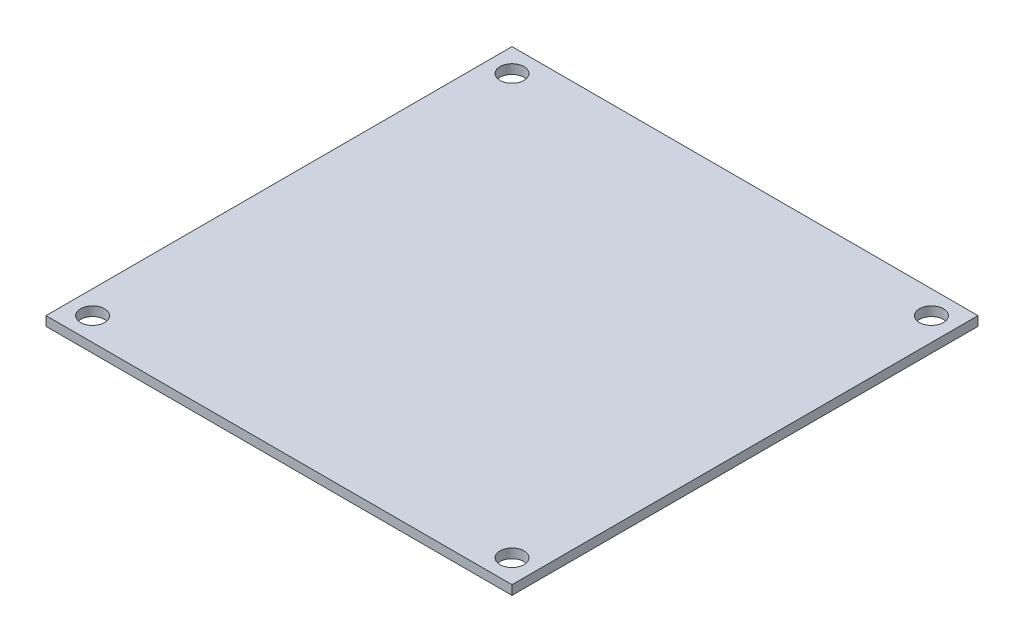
SolidWorks part; units mm, degrees
ref_plane "Front Plane" through (0, 0, 0) normal (0, 0, 1) x (1, 0, 0)
ref_plane "Top Plane" through (0, 0, 0) normal (0, 1, 0) x (1, 0, 0)
ref_plane "Right Plane" through (0, 0, 0) normal (1, 0, 0) x (0, 0, -1)
sketch "Sketch1" plane through (0, 0, 0) normal (0, 1, 0) x (1, 0, 0)
  line L1 (0, 0) -> (63.5, 0)
  line L2 (0, 0) -> (0, 63.5)
  line L3 (0, 63.5) -> (63.5, 63.5)
  line L4 (63.5, 0) -> (63.5, 63.5)
  dimension "D1" = 63.5
  dimension "D2" = 63.5
extrude "Extrude1" add sketch "Sketch1" against normal blind 1.27
hole_wizard "#4 Clearance Hole1" positions "3DSketch1" profile "Sketch2" hole size "#4" standard "Ansi Inch"
sketch3d "3DSketch1"
  circle A0 centre (3.175, -1.27, -60.325) radius 1.524 construction
  circle A1 centre (60.325, -1.27, -60.325) radius 1.524 construction
  circle A2 centre (3.175, -1.27, -3.175) radius 1.524 construction
  circle A3 centre (60.325, -1.27, -3.175) radius 1.524 construction
  point P0 (60.325, 0, -60.325)
  point P2 (3.175, 0, -3.175)
  point P4 (60.325, 0, -3.175)
  point P6 (3.175, 0, -60.325)
  point P11 (3.175, 0.254, -60.325)
  point P14 (60.325, 0.254, -60.325)
  point P17 (3.175, 0.254, -3.175)
  point P20 (60.325, 0.254, -3.175)
sketch "Sketch2" plane through (60.325, 0, -60.325) normal (1, 0, 0) x (0, 0, 1)
  line L0 (0, 0) -> (0, 10.1246)
  line L1 (0, 10.1246) -> (1.6319, 9.144)
  line L2 (1.6319, 9.144) -> (1.6319, 0)
  line L5 (1.6319, 0) -> (0, 0)
  line L10 (0, 10.1246) -> (-1.6319, 9.144) construction
  line L11 (0, -6.35) -> (0, 107.95) construction
  dimension "Hole Dia." = 3.2639
  dimension "Hole Depth" = 9.144
  dimension "Drill Angle" = 118
